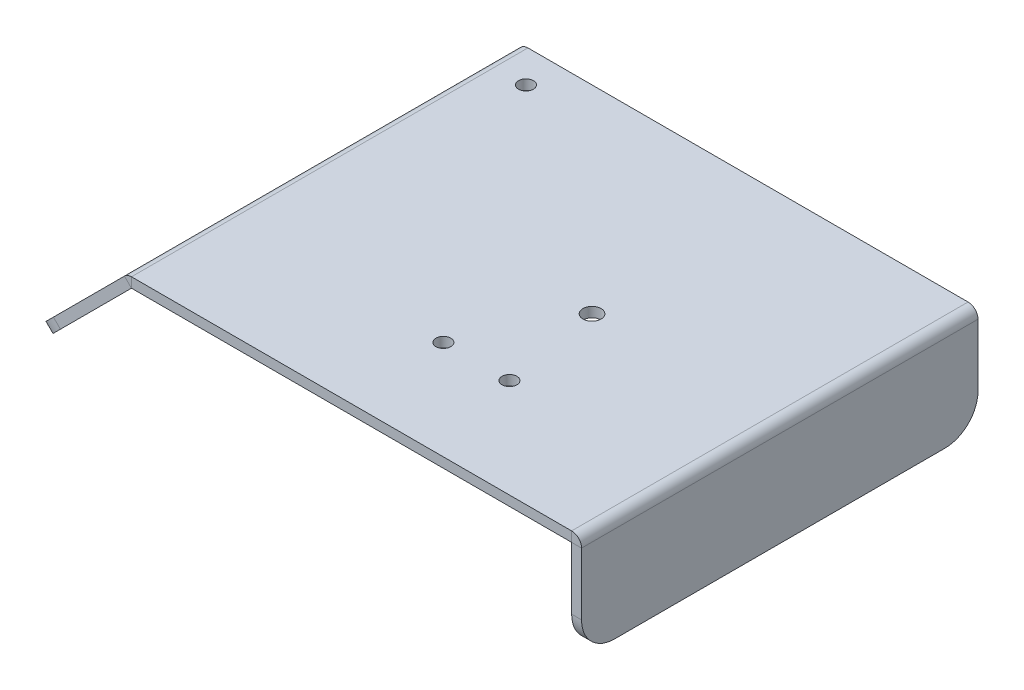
SolidWorks part; units mm, degrees
ref_plane "Front" through (0, 0, 0) normal (0, 0, 1) x (1, 0, 0)
ref_plane "Top" through (0, 0, 0) normal (0, 1, 0) x (1, 0, 0)
ref_plane "Right" through (0, 0, 0) normal (1, 0, 0) x (0, 0, -1)
sketch "Sketch1" plane through (0, 0, 0) normal (0, 1, 0) x (1, 0, 0)
  line L1 (10, 0) -> (196, 0)
  line L2 (0, 10) -> (0, 110)
  line L3 (10, 120) -> (196, 120)
  line L4 (206, 10) -> (206, 110)
  circle A0 centre (25, 30) radius 5
  circle A1 centre (25, 90) radius 2.75
  circle A2 centre (51, 110) radius 2.25
  circle A3 centre (106, 30) radius 2.25
  circle A4 centre (126, 30) radius 2.25
  circle A5 centre (121, 60) radius 2.75
  arc A6 (206, 110) -> (196, 120) centre (196, 110) ccw
  arc A7 (196, 0) -> (206, 10) centre (196, 10) ccw
  arc A8 (0, 10) -> (10, 0) centre (10, 10) ccw
  arc A9 (10, 120) -> (0, 110) centre (10, 110) ccw
  point P13 (0, 0)
sheet metal parameters "Sheet-Metal1" thickness 3 parameters "D1"=0.01
base flange "Base-Flange1" sketch "Sketch1" thickness 3 reverse thickness direction yes parameters "D1"=0.01
sketch "Sketch3" plane through (0, 3, 0) normal (0, 1, 0) x (-1, 0, 0)
  line L0 (-176, -120) -> (-176, 0)
  line L1 (-196, -120) -> (-10, -120) construction
  line L2 (-10, 0) -> (-196, 0) construction
sketched bend "Sketched Bend1" parameters "D1"=1.5
bend "SketchBend1" bend radius 0.01 bend angle 90 parameters "D5"=1
sketch "Sketch4" plane through (0, 3, 0) normal (0, 1, 0) x (-1, 0, 0)
  line L0 (-41, -120) -> (-41, 0)
  line L1 (-174.814, -120) -> (-10, -120) construction
  line L2 (-10, 0) -> (-174.814, 0) construction
sketched bend "Sketched Bend2" parameters "D1"=0.01
bend "SketchBend2" bend radius 0.01 bend angle 45 parameters "D5"=2
flat pattern "Flat-Pattern1"
sketch "Bend-Lines1" plane through (0, 3, 0) normal (0, 1, 0) x (-1, 0, 0)
  line L0 (-41, 0) -> (-41, -120) construction
  line L1 (-176, 0) -> (-176, -120) construction
bend of the flat pattern "Flatten-<SketchBend1>1"
bend of the flat pattern "Flatten-<SketchBend2>1"
